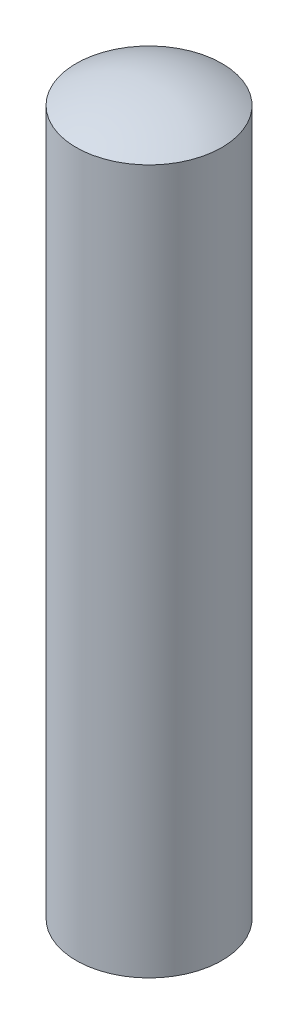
SolidWorks part; units mm, degrees
ref_plane "Face" through (0, 0, 0) normal (0, 0, 1) x (1, 0, 0)
ref_plane "Dessus" through (0, 0, 0) normal (0, 1, 0) x (1, 0, 0)
ref_plane "Droite" through (0, 0, 0) normal (1, 0, 0) x (0, 0, -1)
sketch "Esquisse2" plane through (0, 0, 0) normal (0, 0, 1) x (1, 0, 0)
  line L3 (0, -10) -> (0, 41)
  line L6 (5, -8.6603) -> (5, 39.6603)
  line L7 (0, -10) -> (0, 41) construction
  arc A0 (0, -10) -> (5, -8.6603) centre (0, 0) ccw
  arc A2 (5, 39.6603) -> (0, 41) centre (0, 31) ccw
  dimension "D1" = 20
  dimension "D2" = 10
  dimension "D3" = 31
  dimension "D4" = 5
revolve "Base-Révolution" add sketch "Esquisse2" angle 360 about L7
